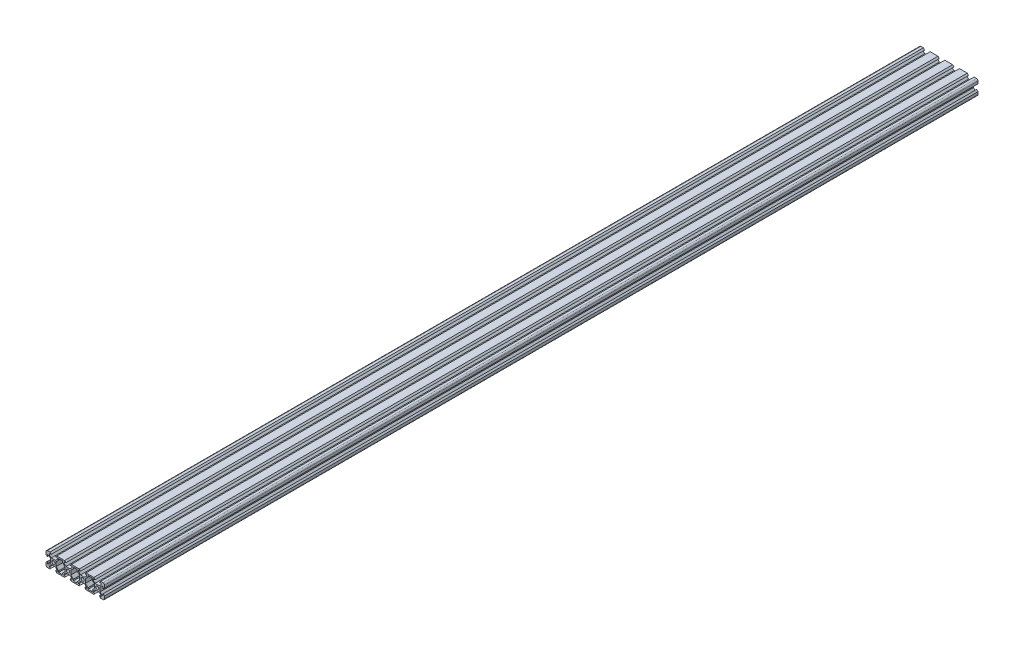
SolidWorks part; units mm, degrees
ref_plane "Front Plane" through (0, 0, 0) normal (0, 0, 1) x (1, 0, 0)
ref_plane "Top Plane" through (0, 0, 0) normal (0, 1, 0) x (1, 0, 0)
ref_plane "Right Plane" through (0, 0, 0) normal (1, 0, 0) x (0, 0, -1)
imported_body "Imported1"
sketch "Sketch1" plane through (0, 0, 25.4) normal (0, 0, 1) x (1, 0, 0)
  line L12 (-17.3007, -8.2) -> (-17.3007, -6.24)
  line L13 (-22.6993, -8.2) -> (-17.3007, -8.2)
  line L14 (-22.6993, -6.24) -> (-22.6993, -8.2)
  line L15 (-26.0993, -2.84) -> (-22.6993, -6.24)
  line L16 (-26.0993, 2.84) -> (-26.0993, -2.84)
  line L17 (-22.6993, 6.24) -> (-26.0993, 2.84)
  line L18 (-22.6993, 8.2) -> (-22.6993, 6.24)
  line L19 (-17.3007, 8.2) -> (-22.6993, 8.2)
  line L20 (-17.3007, 6.24) -> (-17.3007, 8.2)
  line L21 (-13.9007, 2.84) -> (-17.3007, 6.24)
  line L22 (-13.9007, -2.84) -> (-13.9007, 2.84)
  line L23 (-17.3007, -6.24) -> (-13.9007, -2.84)
  line L24 (-17.3007, -8.2) -> (-17.3007, -6.24)
  line L25 (-22.6993, -8.2) -> (-17.3007, -8.2)
  line L26 (-22.6993, -6.24) -> (-22.6993, -8.2)
  line L27 (-26.0993, -2.84) -> (-22.6993, -6.24)
  line L28 (-26.0993, 2.84) -> (-26.0993, -2.84)
  line L29 (-22.6993, 6.24) -> (-26.0993, 2.84)
  line L30 (-22.6993, 8.2) -> (-22.6993, 6.24)
  line L31 (-17.3007, 8.2) -> (-22.6993, 8.2)
  line L32 (-17.3007, 6.24) -> (-17.3007, 8.2)
  line L33 (-13.9007, 2.84) -> (-17.3007, 6.24)
  line L34 (-13.9007, -2.84) -> (-13.9007, 2.84)
  line L35 (-17.3007, -6.24) -> (-13.9007, -2.84)
  line L36 (-2.6993, 8.2) -> (-2.6993, 6.24)
  line L37 (2.6993, 8.2) -> (-2.6993, 8.2)
  line L38 (2.6993, 6.24) -> (2.6993, 8.2)
  line L39 (6.0993, 2.84) -> (2.6993, 6.24)
  line L40 (6.0993, -2.84) -> (6.0993, 2.84)
  line L41 (2.6993, -6.24) -> (6.0993, -2.84)
  line L42 (2.6993, -8.2) -> (2.6993, -6.24)
  line L43 (-2.6993, -8.2) -> (2.6993, -8.2)
  line L44 (-2.6993, -6.24) -> (-2.6993, -8.2)
  line L45 (-6.0993, -2.84) -> (-2.6993, -6.24)
  line L46 (-6.0993, 2.84) -> (-6.0993, -2.84)
  line L47 (-2.6993, 6.24) -> (-6.0993, 2.84)
  line L48 (-2.6993, 8.2) -> (-2.6993, 6.24)
  line L49 (2.6993, 8.2) -> (-2.6993, 8.2)
  line L50 (2.6993, 6.24) -> (2.6993, 8.2)
  line L51 (6.0993, 2.84) -> (2.6993, 6.24)
  line L52 (6.0993, -2.84) -> (6.0993, 2.84)
  line L53 (2.6993, -6.24) -> (6.0993, -2.84)
  line L54 (2.6993, -8.2) -> (2.6993, -6.24)
  line L55 (-2.6993, -8.2) -> (2.6993, -8.2)
  line L56 (-2.6993, -6.24) -> (-2.6993, -8.2)
  line L57 (-6.0993, -2.84) -> (-2.6993, -6.24)
  line L58 (-6.0993, 2.84) -> (-6.0993, -2.84)
  line L59 (-2.6993, 6.24) -> (-6.0993, 2.84)
  line L60 (13.9007, 2.84) -> (13.9007, -2.84)
  line L61 (17.3007, 6.24) -> (13.9007, 2.84)
  line L62 (17.3007, 8.2) -> (17.3007, 6.24)
  line L63 (22.6993, 8.2) -> (17.3007, 8.2)
  line L64 (22.6993, 6.24) -> (22.6993, 8.2)
  line L65 (26.0993, 2.84) -> (22.6993, 6.24)
  line L66 (26.0993, -2.84) -> (26.0993, 2.84)
  line L67 (22.6993, -6.24) -> (26.0993, -2.84)
  line L68 (22.6993, -8.2) -> (22.6993, -6.24)
  line L69 (17.3007, -8.2) -> (22.6993, -8.2)
  line L70 (17.3007, -6.24) -> (17.3007, -8.2)
  line L71 (13.9007, -2.84) -> (17.3007, -6.24)
  line L72 (13.9007, 2.84) -> (13.9007, -2.84)
  line L73 (17.3007, 6.24) -> (13.9007, 2.84)
  line L74 (17.3007, 8.2) -> (17.3007, 6.24)
  line L75 (22.6993, 8.2) -> (17.3007, 8.2)
  line L76 (22.6993, 6.24) -> (22.6993, 8.2)
  line L77 (26.0993, 2.84) -> (22.6993, 6.24)
  line L78 (26.0993, -2.84) -> (26.0993, 2.84)
  line L79 (22.6993, -6.24) -> (26.0993, -2.84)
  line L80 (22.6993, -8.2) -> (22.6993, -6.24)
  line L81 (17.3007, -8.2) -> (22.6993, -8.2)
  line L82 (17.3007, -6.24) -> (17.3007, -8.2)
  line L83 (13.9007, -2.84) -> (17.3007, -6.24)
  line L104 (-15.4993, -8.2) -> (-15.4993, -6.56)
  line L105 (-15.4993, -6.56) -> (-12.84, -3.9007)
  line L106 (-12.84, -3.9007) -> (-7.16, -3.9007)
  line L107 (-7.16, -3.9007) -> (-4.5007, -6.56)
  line L108 (-4.5007, -6.56) -> (-4.5007, -8.2)
  line L109 (-4.5007, -8.2) -> (-7.16, -8.2)
  line L110 (-7.16, -8.2) -> (-5.36, -10)
  line L111 (-5.36, -10) -> (5.36, -10)
  line L112 (5.36, -10) -> (7.16, -8.2)
  line L113 (7.16, -8.2) -> (4.5007, -8.2)
  line L114 (4.5007, -8.2) -> (4.5007, -6.56)
  line L115 (4.5007, -6.56) -> (7.16, -3.9007)
  line L116 (7.16, -3.9007) -> (12.84, -3.9007)
  line L117 (12.84, -3.9007) -> (15.4993, -6.56)
  line L118 (15.4993, -6.56) -> (15.4993, -8.2)
  line L119 (15.4993, -8.2) -> (12.84, -8.2)
  line L120 (12.84, -8.2) -> (14.64, -10)
  line L121 (14.64, -10) -> (25.36, -10)
  line L122 (25.36, -10) -> (27.16, -8.2)
  line L123 (27.16, -8.2) -> (24.5007, -8.2)
  line L124 (24.5007, -8.2) -> (24.5007, -6.56)
  line L125 (24.5007, -6.56) -> (27.16, -3.9007)
  line L126 (27.16, -3.9007) -> (32.84, -3.9007)
  line L127 (32.84, -3.9007) -> (35.4993, -6.56)
  line L128 (35.4993, -6.56) -> (35.4993, -8.2)
  line L129 (35.4993, -8.2) -> (32.84, -8.2)
  line L130 (32.84, -8.2) -> (34.64, -10)
  line L131 (34.64, -10) -> (38, -10)
  line L132 (40, -8) -> (40, -4.64)
  line L133 (40, -4.64) -> (38.2, -2.84)
  line L134 (38.2, -2.84) -> (38.2, -5.4993)
  line L135 (38.2, -5.4993) -> (36.56, -5.4993)
  line L136 (36.56, -5.4993) -> (33.9007, -2.84)
  line L137 (33.9007, -2.84) -> (33.9007, 2.84)
  line L138 (33.9007, 2.84) -> (36.56, 5.4993)
  line L139 (36.56, 5.4993) -> (38.2, 5.4993)
  line L140 (38.2, 5.4993) -> (38.2, 2.84)
  line L141 (38.2, 2.84) -> (40, 4.64)
  line L142 (40, 4.64) -> (40, 8)
  line L143 (38, 10) -> (34.64, 10)
  line L144 (34.64, 10) -> (32.84, 8.2)
  line L145 (32.84, 8.2) -> (35.4993, 8.2)
  line L146 (35.4993, 8.2) -> (35.4993, 6.56)
  line L147 (35.4993, 6.56) -> (32.84, 3.9007)
  line L148 (32.84, 3.9007) -> (27.16, 3.9007)
  line L149 (27.16, 3.9007) -> (24.5007, 6.56)
  line L150 (24.5007, 6.56) -> (24.5007, 8.2)
  line L151 (24.5007, 8.2) -> (27.16, 8.2)
  line L152 (27.16, 8.2) -> (25.36, 10)
  line L153 (25.36, 10) -> (14.64, 10)
  line L154 (14.64, 10) -> (12.84, 8.2)
  line L155 (12.84, 8.2) -> (15.4993, 8.2)
  line L156 (15.4993, 8.2) -> (15.4993, 6.56)
  line L157 (15.4993, 6.56) -> (12.84, 3.9007)
  line L158 (12.84, 3.9007) -> (7.16, 3.9007)
  line L159 (7.16, 3.9007) -> (4.5007, 6.56)
  line L160 (4.5007, 6.56) -> (4.5007, 8.2)
  line L161 (4.5007, 8.2) -> (7.16, 8.2)
  line L162 (7.16, 8.2) -> (5.36, 10)
  line L163 (5.36, 10) -> (-5.36, 10)
  line L164 (-5.36, 10) -> (-7.16, 8.2)
  line L165 (-7.16, 8.2) -> (-4.5007, 8.2)
  line L166 (-4.5007, 8.2) -> (-4.5007, 6.56)
  line L167 (-4.5007, 6.56) -> (-7.16, 3.9007)
  line L168 (-7.16, 3.9007) -> (-12.84, 3.9007)
  line L169 (-12.84, 3.9007) -> (-15.4993, 6.56)
  line L170 (-15.4993, 6.56) -> (-15.4993, 8.2)
  line L171 (-15.4993, 8.2) -> (-12.84, 8.2)
  line L172 (-12.84, 8.2) -> (-14.64, 10)
  line L173 (-14.64, 10) -> (-25.36, 10)
  line L174 (-25.36, 10) -> (-27.16, 8.2)
  line L175 (-27.16, 8.2) -> (-24.5007, 8.2)
  line L176 (-24.5007, 8.2) -> (-24.5007, 6.56)
  line L177 (-24.5007, 6.56) -> (-27.16, 3.9007)
  line L178 (-27.16, 3.9007) -> (-32.84, 3.9007)
  line L179 (-32.84, 3.9007) -> (-35.4993, 6.56)
  line L180 (-35.4993, 6.56) -> (-35.4993, 8.2)
  line L181 (-35.4993, 8.2) -> (-32.84, 8.2)
  line L182 (-32.84, 8.2) -> (-34.64, 10)
  line L183 (-34.64, 10) -> (-38, 10)
  line L184 (-40, 8) -> (-40, 4.64)
  line L185 (-40, 4.64) -> (-38.2, 2.84)
  line L186 (-38.2, 2.84) -> (-38.2, 5.4993)
  line L187 (-38.2, 5.4993) -> (-36.56, 5.4993)
  line L188 (-36.56, 5.4993) -> (-33.9007, 2.84)
  line L189 (-33.9007, 2.84) -> (-33.9007, -2.84)
  line L190 (-33.9007, -2.84) -> (-36.56, -5.4993)
  line L191 (-36.56, -5.4993) -> (-38.2, -5.4993)
  line L192 (-38.2, -5.4993) -> (-38.2, -2.84)
  line L193 (-38.2, -2.84) -> (-40, -4.64)
  line L194 (-40, -4.64) -> (-40, -8)
  line L195 (-38, -10) -> (-34.64, -10)
  line L196 (-34.64, -10) -> (-32.84, -8.2)
  line L197 (-32.84, -8.2) -> (-35.4993, -8.2)
  line L198 (-35.4993, -8.2) -> (-35.4993, -6.56)
  line L199 (-35.4993, -6.56) -> (-32.84, -3.9007)
  line L200 (-32.84, -3.9007) -> (-27.16, -3.9007)
  line L201 (-27.16, -3.9007) -> (-24.5007, -6.56)
  line L202 (-24.5007, -6.56) -> (-24.5007, -8.2)
  line L203 (-24.5007, -8.2) -> (-27.16, -8.2)
  line L204 (-27.16, -8.2) -> (-25.36, -10)
  line L205 (-25.36, -10) -> (-14.64, -10)
  line L206 (-14.64, -10) -> (-12.84, -8.2)
  line L207 (-12.84, -8.2) -> (-15.4993, -8.2)
  line L208 (-15.4993, -8.2) -> (-15.4993, -6.56)
  line L209 (-15.4993, -6.56) -> (-12.84, -3.9007)
  line L210 (-12.84, -3.9007) -> (-7.16, -3.9007)
  line L211 (-7.16, -3.9007) -> (-4.5007, -6.56)
  line L212 (-4.5007, -6.56) -> (-4.5007, -8.2)
  line L213 (-4.5007, -8.2) -> (-7.16, -8.2)
  line L214 (-7.16, -8.2) -> (-5.36, -10)
  line L215 (-5.36, -10) -> (5.36, -10)
  line L216 (5.36, -10) -> (7.16, -8.2)
  line L217 (7.16, -8.2) -> (4.5007, -8.2)
  line L218 (4.5007, -8.2) -> (4.5007, -6.56)
  line L219 (4.5007, -6.56) -> (7.16, -3.9007)
  line L220 (7.16, -3.9007) -> (12.84, -3.9007)
  line L221 (12.84, -3.9007) -> (15.4993, -6.56)
  line L222 (15.4993, -6.56) -> (15.4993, -8.2)
  line L223 (15.4993, -8.2) -> (12.84, -8.2)
  line L224 (12.84, -8.2) -> (14.64, -10)
  line L225 (14.64, -10) -> (25.36, -10)
  line L226 (25.36, -10) -> (27.16, -8.2)
  line L227 (27.16, -8.2) -> (24.5007, -8.2)
  line L228 (24.5007, -8.2) -> (24.5007, -6.56)
  line L229 (24.5007, -6.56) -> (27.16, -3.9007)
  line L230 (27.16, -3.9007) -> (32.84, -3.9007)
  line L231 (32.84, -3.9007) -> (35.4993, -6.56)
  line L232 (35.4993, -6.56) -> (35.4993, -8.2)
  line L233 (35.4993, -8.2) -> (32.84, -8.2)
  line L234 (32.84, -8.2) -> (34.64, -10)
  line L235 (34.64, -10) -> (38, -10)
  line L236 (40, -8) -> (40, -4.64)
  line L237 (40, -4.64) -> (38.2, -2.84)
  line L238 (38.2, -2.84) -> (38.2, -5.4993)
  line L239 (38.2, -5.4993) -> (36.56, -5.4993)
  line L240 (36.56, -5.4993) -> (33.9007, -2.84)
  line L241 (33.9007, -2.84) -> (33.9007, 2.84)
  line L242 (33.9007, 2.84) -> (36.56, 5.4993)
  line L243 (36.56, 5.4993) -> (38.2, 5.4993)
  line L244 (38.2, 5.4993) -> (38.2, 2.84)
  line L245 (38.2, 2.84) -> (40, 4.64)
  line L246 (40, 4.64) -> (40, 8)
  line L247 (38, 10) -> (34.64, 10)
  line L248 (34.64, 10) -> (32.84, 8.2)
  line L249 (32.84, 8.2) -> (35.4993, 8.2)
  line L250 (35.4993, 8.2) -> (35.4993, 6.56)
  line L251 (35.4993, 6.56) -> (32.84, 3.9007)
  line L252 (32.84, 3.9007) -> (27.16, 3.9007)
  line L253 (27.16, 3.9007) -> (24.5007, 6.56)
  line L254 (24.5007, 6.56) -> (24.5007, 8.2)
  line L255 (24.5007, 8.2) -> (27.16, 8.2)
  line L256 (27.16, 8.2) -> (25.36, 10)
  line L257 (25.36, 10) -> (14.64, 10)
  line L258 (14.64, 10) -> (12.84, 8.2)
  line L259 (12.84, 8.2) -> (15.4993, 8.2)
  line L260 (15.4993, 8.2) -> (15.4993, 6.56)
  line L261 (15.4993, 6.56) -> (12.84, 3.9007)
  line L262 (12.84, 3.9007) -> (7.16, 3.9007)
  line L263 (7.16, 3.9007) -> (4.5007, 6.56)
  line L264 (4.5007, 6.56) -> (4.5007, 8.2)
  line L265 (4.5007, 8.2) -> (7.16, 8.2)
  line L266 (7.16, 8.2) -> (5.36, 10)
  line L267 (5.36, 10) -> (-5.36, 10)
  line L268 (-5.36, 10) -> (-7.16, 8.2)
  line L269 (-7.16, 8.2) -> (-4.5007, 8.2)
  line L270 (-4.5007, 8.2) -> (-4.5007, 6.56)
  line L271 (-4.5007, 6.56) -> (-7.16, 3.9007)
  line L272 (-7.16, 3.9007) -> (-12.84, 3.9007)
  line L273 (-12.84, 3.9007) -> (-15.4993, 6.56)
  line L274 (-15.4993, 6.56) -> (-15.4993, 8.2)
  line L275 (-15.4993, 8.2) -> (-12.84, 8.2)
  line L276 (-12.84, 8.2) -> (-14.64, 10)
  line L277 (-14.64, 10) -> (-25.36, 10)
  line L278 (-25.36, 10) -> (-27.16, 8.2)
  line L279 (-27.16, 8.2) -> (-24.5007, 8.2)
  line L280 (-24.5007, 8.2) -> (-24.5007, 6.56)
  line L281 (-24.5007, 6.56) -> (-27.16, 3.9007)
  line L282 (-27.16, 3.9007) -> (-32.84, 3.9007)
  line L283 (-32.84, 3.9007) -> (-35.4993, 6.56)
  line L284 (-35.4993, 6.56) -> (-35.4993, 8.2)
  line L285 (-35.4993, 8.2) -> (-32.84, 8.2)
  line L286 (-32.84, 8.2) -> (-34.64, 10)
  line L287 (-34.64, 10) -> (-38, 10)
  line L288 (-40, 8) -> (-40, 4.64)
  line L289 (-40, 4.64) -> (-38.2, 2.84)
  line L290 (-38.2, 2.84) -> (-38.2, 5.4993)
  line L291 (-38.2, 5.4993) -> (-36.56, 5.4993)
  line L292 (-36.56, 5.4993) -> (-33.9007, 2.84)
  line L293 (-33.9007, 2.84) -> (-33.9007, -2.84)
  line L294 (-33.9007, -2.84) -> (-36.56, -5.4993)
  line L295 (-36.56, -5.4993) -> (-38.2, -5.4993)
  line L296 (-38.2, -5.4993) -> (-38.2, -2.84)
  line L297 (-38.2, -2.84) -> (-40, -4.64)
  line L298 (-40, -4.64) -> (-40, -8)
  line L299 (-38, -10) -> (-34.64, -10)
  line L300 (-34.64, -10) -> (-32.84, -8.2)
  line L301 (-32.84, -8.2) -> (-35.4993, -8.2)
  line L302 (-35.4993, -8.2) -> (-35.4993, -6.56)
  line L303 (-35.4993, -6.56) -> (-32.84, -3.9007)
  line L304 (-32.84, -3.9007) -> (-27.16, -3.9007)
  line L305 (-27.16, -3.9007) -> (-24.5007, -6.56)
  line L306 (-24.5007, -6.56) -> (-24.5007, -8.2)
  line L307 (-24.5007, -8.2) -> (-27.16, -8.2)
  line L308 (-27.16, -8.2) -> (-25.36, -10)
  line L309 (-25.36, -10) -> (-14.64, -10)
  line L310 (-14.64, -10) -> (-12.84, -8.2)
  line L311 (-12.84, -8.2) -> (-15.4993, -8.2)
  circle A0 centre (-30, 0) radius 2.1 construction
  circle A1 centre (-10, 0) radius 2.1 construction
  circle A2 centre (10, 0) radius 2.1 construction
  circle A3 centre (30, 0) radius 2.1 construction
  arc A4 (38, -10) -> (40, -8) centre (38, -8) ccw
  arc A5 (40, 8) -> (38, 10) centre (38, 8) ccw
  arc A6 (-38, 10) -> (-40, 8) centre (-38, 8) ccw
  arc A7 (-40, -8) -> (-38, -10) centre (-38, -8) ccw
  arc A8 (38, -10) -> (40, -8) centre (38, -8) ccw
  arc A9 (40, 8) -> (38, 10) centre (38, 8) ccw
  arc A10 (-38, 10) -> (-40, 8) centre (-38, 8) ccw
  arc A11 (-40, -8) -> (-38, -10) centre (-38, -8) ccw
  circle A12 centre (-30, 0) radius 2.1
  circle A13 centre (-10, 0) radius 2.1
  circle A14 centre (10, 0) radius 2.1
  circle A15 centre (30, 0) radius 2.1
  dimension "D1" = 0
  dimension "D2" = 0
  dimension "D3" = 0
  dimension "D4" = 0
extrude "Boss-Extrude1" add sketch "Sketch1" along normal blind 1168.4
ref_plane "Plane1" through (0, 0, 0) normal (0, -1, 0) x (1, 0, 0)
